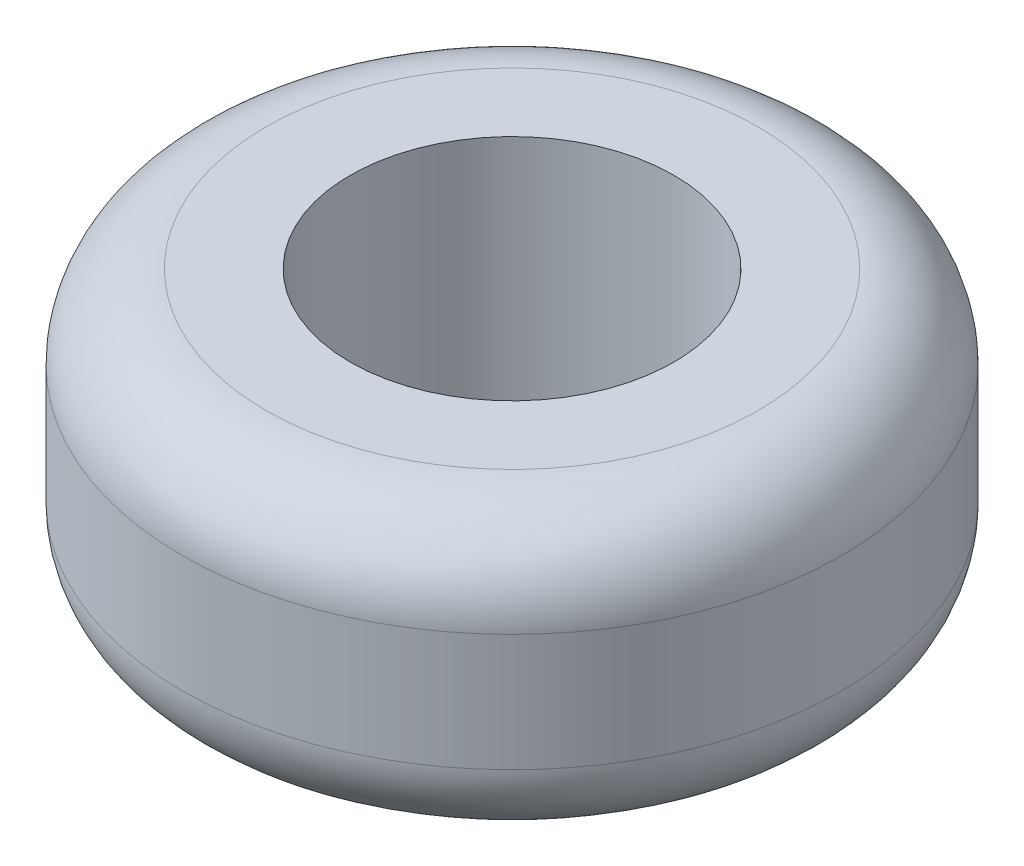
SolidWorks part; units mm, degrees
ref_plane "Front" through (0, 0, 0) normal (0, 0, 1) x (1, 0, 0)
ref_plane "Top" through (0, 0, 0) normal (0, 1, 0) x (1, 0, 0)
ref_plane "Right" through (0, 0, 0) normal (1, 0, 0) x (0, 0, -1)
sketch "Sketch1" plane through (0, 0, 0) normal (0, 1, 0) x (1, 0, 0)
  circle A0 centre (0, 0) radius 12.5016
  circle A1 centre (0, 0) radius 6.1404
  dimension "D1" = 25.0031
  dimension "D2" = 12.2809
extrude "Boss-Extrude1" add sketch "Sketch1" along normal blind 10.795
fillet "Fillet1" radius 3.175 2 edges at (0, 0, 12.5016) (0, 10.795, 12.5016)
